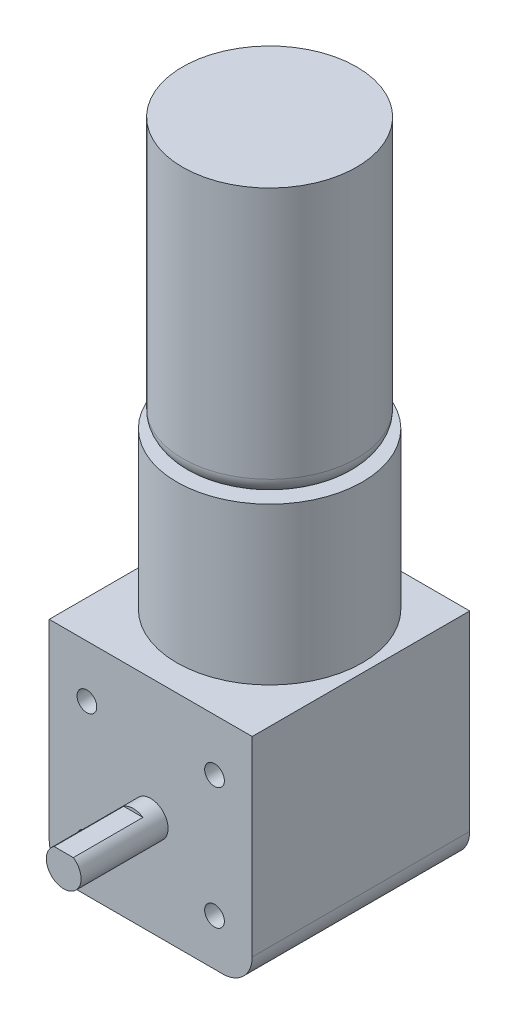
SolidWorks part; units mm, degrees
ref_plane "Front Plane" through (0, 0, 0) normal (0, 0, 1) x (1, 0, 0)
ref_plane "Top Plane" through (0, 0, 0) normal (0, 1, 0) x (1, 0, 0)
ref_plane "Right Plane" through (0, 0, 0) normal (1, 0, 0) x (0, 0, -1)
sketch "Sketch1" plane through (0, 0, 0) normal (0, 1, 0) x (1, 0, 0)
  line L1 (-17.5, 18.75) -> (17.5, 18.75)
  line L2 (-17.5, 18.75) -> (-17.5, -18.75)
  line L3 (-17.5, -18.75) -> (17.5, -18.75)
  line L4 (17.5, 18.75) -> (17.5, -18.75)
  line L5 (-17.5, 18.75) -> (17.5, -18.75) construction
  line L6 (-17.5, -18.75) -> (17.5, 18.75) construction
  point P0 (0, 0)
  dimension "D1" = 35
  dimension "D2" = 37.5
extrude "Boss-Extrude1" add sketch "Sketch1" against normal blind 38
sketch "Sketch2" plane through (0, 0, 0) normal (0, 1, 0) x (1, 0, 0)
  line L0 (-17.5, 17.75) -> (17.5, 17.75) construction
  line L1 (-17.5, 18.75) -> (-17.5, -18.75) construction
  line L2 (17.5, -18.75) -> (17.5, 18.75) construction
  line L3 (17.5, 18.75) -> (-17.5, 18.75) construction
  circle A0 centre (0, 1.75) radius 16
  dimension "D1" = 32
  dimension "D2" = 1
extrude "Boss-Extrude2" add sketch "Sketch2" along normal blind 27
sketch "Sketch3" plane through (0, 27, 0) normal (0, 1, 0) x (1, 0, 0)
  circle A0 centre (0, 1.75) radius 15
  dimension "D1" = 30
extrude "Boss-Extrude3" add sketch "Sketch3" along normal blind 46.5
sketch "Sketch7" plane through (0, 0, 0) normal (1, 0, 0) x (0, 0, -1)
  line L0 (1.75, 73.5) -> (1.75, 11.5842) construction
  line L1 (16.75, 73.5) -> (-13.25, 73.5) construction
  line L2 (16.75, 27) -> (16.75, 73.5) construction
  line L3 (17.75, 27) -> (-14.25, 27) construction
  line L4 (16.75, 27) -> (16.75, 73.5) construction
  line L5 (13.75, 27) -> (16.75, 27)
  line L6 (16.75, 27) -> (16.75, 73.5) construction
  line L7 (16.75, 27) -> (16.75, 30)
  arc A0 (16.75, 30) -> (13.75, 27) centre (13.75, 30) cw
  point P4 (13.75, 30)
  dimension "D1" = 3
  dimension "D2" = 3
revolve "Cut-Revolve2" cut sketch "Sketch7" angle 360 about L0
sketch "Sketch8" plane through (0, 0, 18.75) normal (0, 0, 1) x (1, 0, 0)
  line L0 (-17.5, 0) -> (17.5, 0) construction
  circle A0 centre (0, -21) radius 3
  dimension "D1" = 6
  dimension "D2" = 21
extrude "Boss-Extrude4" add sketch "Sketch8" along normal blind 15
sketch "Sketch9" plane through (0, 0, 18.75) normal (0, 0, 1) x (1, 0, 0)
  line L0 (-17.5, -38) -> (-17.5, 0) construction
  line L1 (-17.5, -38) -> (17.5, -38) construction
  line L2 (0, 0) -> (0, -12.644) construction
  point P0 (-11, -9)
  point P1 (-11, -30)
  point P9 (11, -30)
  point P10 (11, -9)
  dimension "D1" = 6.5
  dimension "D2" = 21
  dimension "D3" = 8
hole_wizard "M3 Clearance Hole1" positions "Sketch11" profile "Sketch10" hole size "M3" standard "ANSI Metric"
sketch "Sketch11" plane through (0, 0, 18.75) normal (0, 0, 1) x (1, 0, 0)
  point P0 (-11, -9)
  point P3 (11, -9)
  point P6 (11, -30)
  point P9 (-11, -30)
sketch "Sketch10" plane through (-11, -9, 18.75) normal (1, 0, 0) x (0, -1, 0)
  line L0 (0, 0) -> (0, 13.7215)
  line L1 (0, 13.7215) -> (1.7, 12.7)
  line L2 (1.7, 12.7) -> (1.7, 0)
  line L5 (1.7, 0) -> (0, 0)
  line L10 (0, 13.7215) -> (-1.7, 12.7) construction
  line L11 (0, -6.35) -> (0, 107.95) construction
  dimension "Hole Dia." = 3.4
  dimension "Hole Depth" = 12.7
  dimension "Drill Angle" = 118
fillet "Fillet1" radius 5.08 2 edges at (-17.5, -38, 0) (17.5, -38, 0)
sketch "Sketch12" plane through (0, 0, 33.75) normal (0, 0, 1) x (1, 0, 0)
  line L1 (-2.54, -18) -> (2.54, -18)
  line L2 (-2.54, -18) -> (-2.54, -18.5)
  line L3 (-2.54, -18.5) -> (2.54, -18.5)
  line L4 (2.54, -18) -> (2.54, -18.5)
  line L5 (-2.54, -18) -> (2.54, -18.5) construction
  line L6 (-2.54, -18.5) -> (2.54, -18) construction
  circle A0 centre (0, -21) radius 3 construction
  point P0 (0, -18.25)
  dimension "D1" = 0.5
  dimension "D2" = 5.08
extrude "Cut-Extrude1" cut sketch "Sketch12" against normal blind 12
